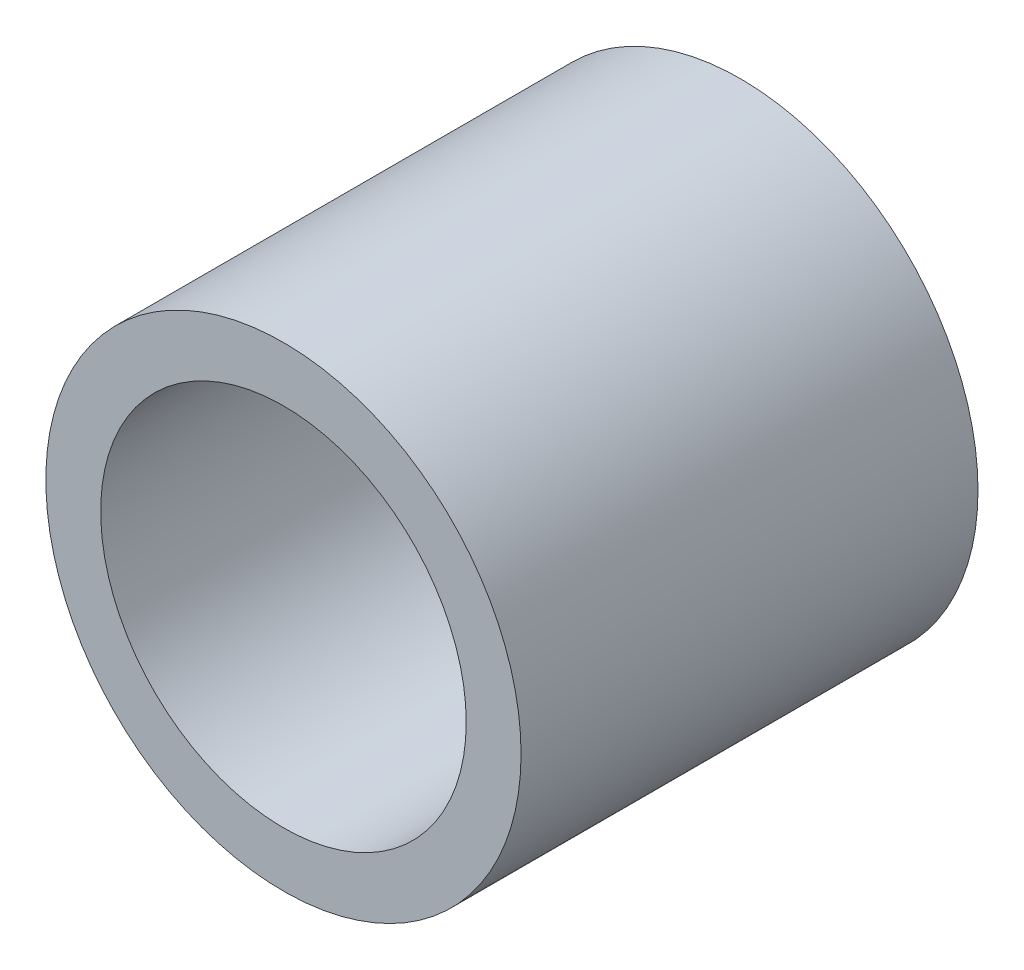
SolidWorks part; units mm, degrees
ref_plane "Plan de face" through (0, 0, 0) normal (0, 0, 1) x (1, 0, 0)
ref_plane "Plan de dessus" through (0, 0, 0) normal (0, 1, 0) x (1, 0, 0)
ref_plane "Plan de droite" through (0, 0, 0) normal (1, 0, 0) x (0, 0, -1)
sketch "Esquisse1" plane through (0, 0, 0) normal (0, 0, 1) x (1, 0, 0)
  circle A0 centre (0, 0) radius 10
  circle A1 centre (0, 0) radius 13
  dimension "D2" = 26
  dimension "D1" = 20
extrude "Extrusion1" add sketch "Esquisse1" along normal mid plane 25
